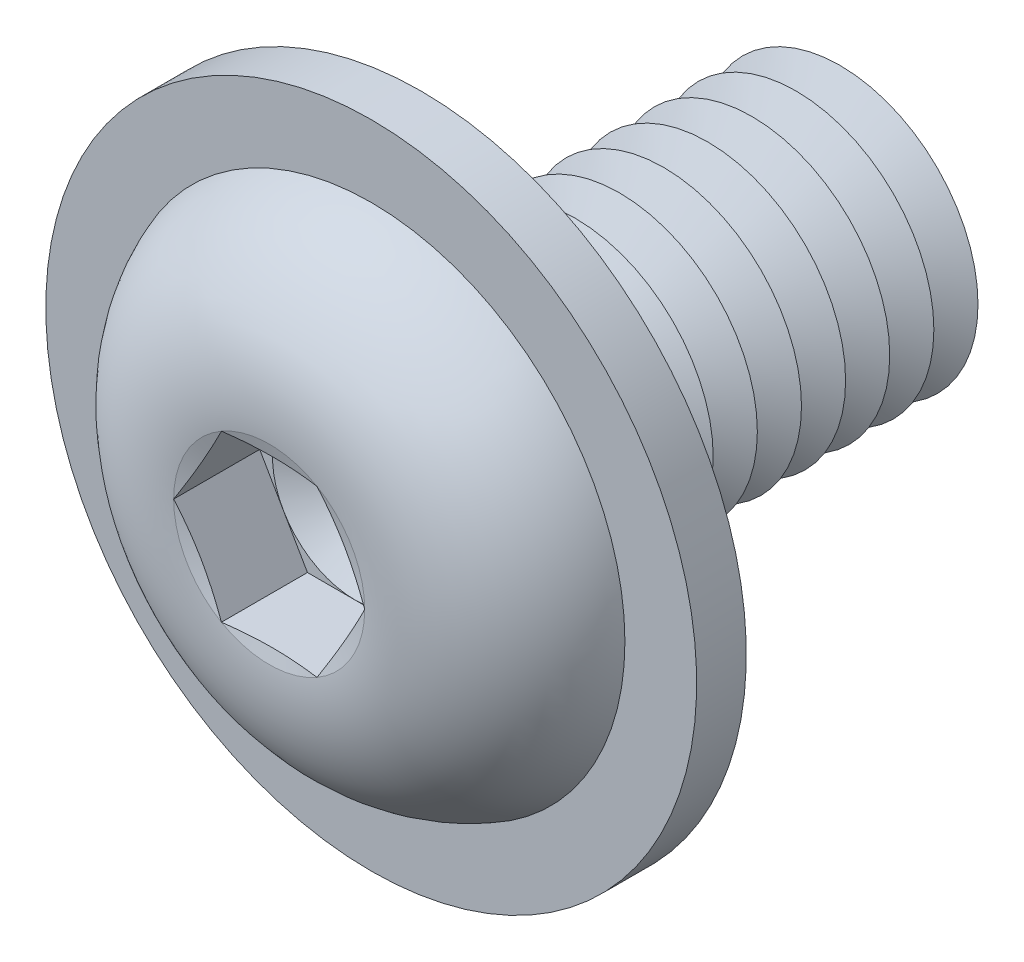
SolidWorks part; units mm, degrees
ref_plane "Front Plane" through (0, 0, 0) normal (0, 0, 1) x (1, 0, 0)
ref_plane "Top Plane" through (0, 0, 0) normal (0, 1, 0) x (1, 0, 0)
ref_plane "Right Plane" through (0, 0, 0) normal (1, 0, 0) x (0, 0, -1)
sketch "Sketch1" plane through (0, 0, 0) normal (1, 0, 0) x (0, 0, -1)
  line L0 (0, 2.5) -> (0, 4.75)
  line L3 (0, 2.5) -> (8, 2.5)
  line L4 (8, 2.5) -> (8, 0)
  line L5 (8, 0) -> (-2.75, 0) construction
  line L6 (-2.75, 0) -> (8, 0)
  line L7 (-2.75, 1.732) -> (-2.75, 0.866) construction
  line L8 (-2.75, 0.866) -> (-2.75, 0)
  line L9 (-2.75, 1.732) -> (-2.5179, 0.866)
  line L10 (-2.5179, 0.866) -> (-2.75, 0.866)
  line L11 (8, 0) -> (22.7481, 0) construction
  line L12 (0, 4.75) -> (-2.75, 4.75) construction
  arc A1 (0, 4.75) -> (-2.75, 1.732) centre (0, 1.9881) ccw
  point P8 (8, 1.25)
  dimension "D1" = 9.5
  dimension "D2" = 5
  dimension "D3" = 2.75
  dimension "D4" = 3.4641
  dimension "D5" = 8
  dimension "D6" = 15
revolve "Revolve1" add sketch "Sketch1" angle 360 about L5
fillet "Fillet1" radius 0.4 1 edges at (-2.5, 0, 0)
sketch "Sketch2" plane through (0, 0, 0) normal (1, 0, 0) x (0, 0, -1)
  line L0 (7.6, 2.5) -> (8.4, 2.5)
  line L1 (8, 2.5) -> (0.4, 2.5) construction
  line L2 (8.4, 2.5) -> (8, 1.8072)
  line L3 (8, -2.5) -> (8, 2.5) construction
  line L4 (8, 1.8072) -> (7.6, 2.5)
  dimension "D1" = 0.8
revolve "Cut-Revolve1" cut sketch "Sketch2" angle 360 about axis through (0, 0, -8) along (0, 0, -1)
pattern_linear "LPattern1" count 10 spacing 0.8 along (0, 0, 1) of "Cut-Revolve1"
sketch "Sketch3" plane through (0, 0, 2.75) normal (0, 0, 1) x (1, 0, 0)
  line L7 (0.866, 1.5) -> (-0.866, 1.5)
  line L8 (-0.866, 1.5) -> (-1.7321, 0)
  line L9 (-1.7321, 0) -> (-0.866, -1.5)
  line L10 (-0.866, -1.5) -> (0.866, -1.5)
  line L11 (0.866, -1.5) -> (1.732, 0)
  line L12 (1.732, 0) -> (0.866, 1.5)
  circle A0 centre (0, 0) radius 1.5 construction
  circle A3 centre (0, 0) radius 1.7321 construction
extrude "Cut-Extrude1" cut sketch "Sketch3" against normal blind 1.56
sketch "Sketch4" plane through (0, 0, 1.19) normal (0, 0, 1) x (1, 0, 0)
  line L1 (0.866, 1.5) -> (-0.866, 1.5) construction
  circle A0 centre (0, 0) radius 1.5
extrude "Cut-Extrude2" cut sketch "Sketch4" against normal through all draft 60
sketch "Sketch5" plane through (0, 0, 0) normal (0, 0, -1) x (-1, 0, 0)
  circle A0 centre (0, 0) radius 5.9
  circle A1 centre (0, 0) radius 2.9
  circle A2 centre (0, 0) radius 2.9 construction
  dimension "D1" = 11.8
extrude "Boss-Extrude1" add sketch "Sketch5" against normal blind 0.9
